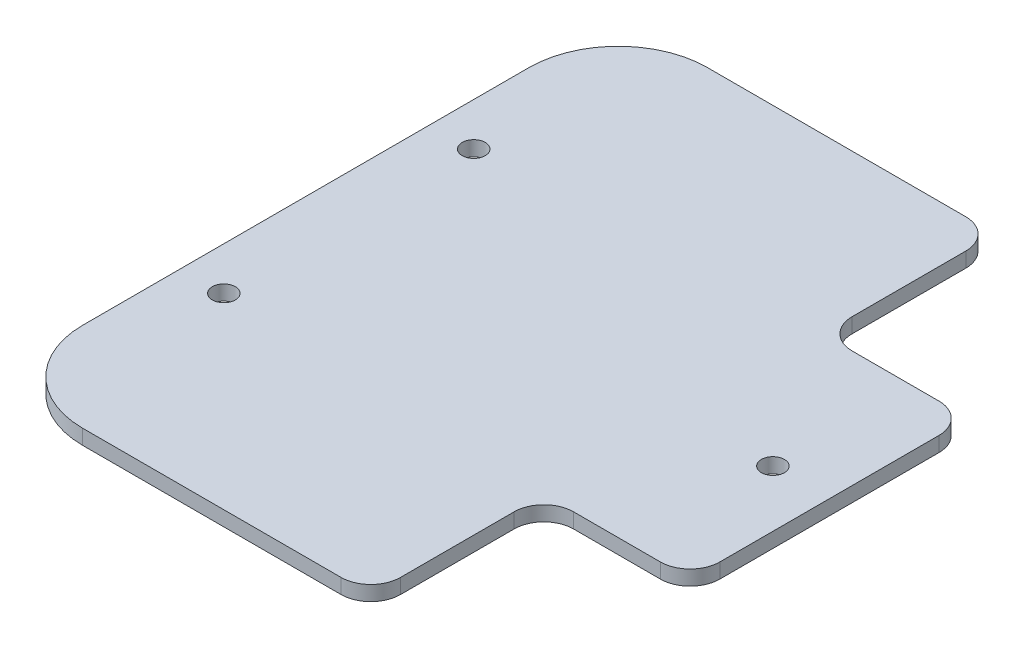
SolidWorks part; units mm, degrees
ref_plane "Front Plane" through (0, 0, 0) normal (0, 0, 1) x (1, 0, 0)
ref_plane "Top Plane" through (0, 0, 0) normal (0, 1, 0) x (1, 0, 0)
ref_plane "Right Plane" through (0, 0, 0) normal (1, 0, 0) x (0, 0, -1)
sketch "Sketch1" plane through (0, 0, 0) normal (0, 1, 0) x (1, 0, 0)
  line L2 (0, 0) -> (48.895, 0) construction
  line L3 (-41.6356, 26.67) -> (0, 0) construction
  line L8 (54.61, 29.7354) -> (36.0854, 29.7354)
  line L9 (60.96, 23.3854) -> (60.96, -23.3854)
  line L10 (23.3854, -66.675) -> (-31.75, -66.675)
  line L11 (54.61, -29.7354) -> (36.0854, -29.7354)
  line L12 (29.7354, -36.0854) -> (29.7354, -60.325)
  line L16 (0, 0) -> (0, -66.675) construction
  line L18 (23.3854, 66.675) -> (-31.75, 66.675)
  line L19 (29.7354, 36.0854) -> (29.7354, 60.325)
  line L21 (-50.8, 47.625) -> (-50.8, -47.625)
  circle A4 centre (-41.6356, 26.67) radius 3.9688 construction
  circle A5 centre (-41.6356, -26.67) radius 3.9687 construction
  circle A8 centre (48.895, 0) radius 3.9687 construction
  circle A12 centre (48.895, 0) radius 1.7272 construction
  circle A13 centre (-41.6356, 26.67) radius 1.7272 construction
  arc A16 (54.61, 29.7354) -> (60.96, 23.3854) centre (54.61, 23.3854) cw
  arc A17 (60.96, -23.3854) -> (54.61, -29.7354) centre (54.61, -23.3854) cw
  arc A18 (29.7354, -36.0854) -> (36.0854, -29.7354) centre (36.0854, -36.0854) cw
  arc A19 (29.7354, -60.325) -> (23.3854, -66.675) centre (23.3854, -60.325) cw
  arc A20 (23.3854, 66.675) -> (29.7354, 60.325) centre (23.3854, 60.325) cw
  arc A21 (29.7354, 36.0854) -> (36.0854, 29.7354) centre (36.0854, 36.0854) ccw
  arc A22 (-50.8, -47.625) -> (-31.75, -66.675) centre (-31.75, -47.625) ccw
  arc A23 (-31.75, 66.675) -> (-50.8, 47.625) centre (-31.75, 47.625) ccw
  circle A24 centre (36.0854, -36.0854) radius 4.7625 construction
  point P30 (60.96, 29.7354)
  point P33 (60.96, -29.7354)
  point P36 (29.7354, -29.7354)
  point P39 (29.7354, -66.675)
  point P42 (29.7354, 66.675)
  point P45 (29.7354, 29.7354)
  point P50 (-50.8, -66.675)
  point P53 (-50.8, 66.675)
  dimension "D1" = 3.9687
  dimension "D2" = 60.96
  dimension "D3" = 6.35
  dimension "D7" = 19.05
  dimension "D5" = 133.35
  dimension "D8" = 50.8
extrude "Boss-Extrude1" add sketch "Sketch1" along normal blind 3.175
hole_wizard "#10 (0.1935) Diameter Hole1" positions "Sketch2" profile "Sketch3" hole size "#10" standard "ANSI Inch"
sketch "Sketch2" plane through (0, 3.175, 0) normal (0, 1, 0) x (1, 0, 0)
  circle A3 centre (48.895, 0) radius 3.9687 construction
  circle A4 centre (-41.6356, -26.67) radius 3.9687 construction
  circle A5 centre (-41.6356, 26.67) radius 3.9688 construction
  point P0 (48.895, 0)
  point P3 (-41.6356, 26.67)
  point P5 (-41.6356, -26.67)
sketch "Sketch3" plane through (48.895, 3.175, 0) normal (1, 0, 0) x (0, 0, 1)
  line L0 (0, 0) -> (0, 3.175)
  line L1 (0, 3.175) -> (2.4574, 3.175)
  line L2 (2.4574, 3.175) -> (2.4574, 0)
  line L5 (2.4574, 0) -> (0, 0)
  line L11 (0, -6.35) -> (0, 107.95) construction
  dimension "Thru Hole Dia." = 4.9149
  dimension "Thru Hole Depth" = 3.175
